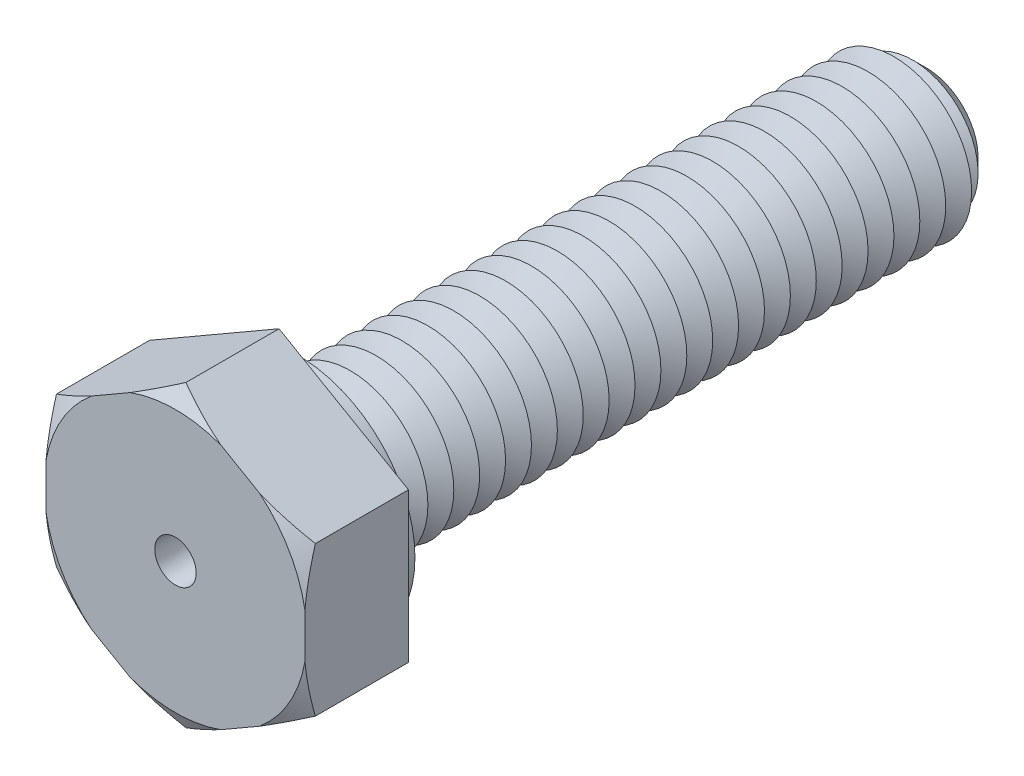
SolidWorks part; units mm, degrees
ref_plane "Front Plane" through (0, 0, 0) normal (0, 0, 1) x (1, 0, 0)
ref_plane "Top Plane" through (0, 0, 0) normal (0, 1, 0) x (1, 0, 0)
ref_plane "Right Plane" through (0, 0, 0) normal (1, 0, 0) x (0, 0, -1)
sketch "Sketch2" plane through (0, 0, 0) normal (0, 0, 1) x (1, 0, 0)
  line L1 (0, 5.7735) -> (-5, 2.8868)
  line L2 (-5, 2.8868) -> (-5, -2.8868)
  line L3 (-5, -2.8868) -> (0, -5.7735)
  line L4 (0, -5.7735) -> (5, -2.8868)
  line L5 (5, -2.8868) -> (5, 2.8868)
  line L6 (5, 2.8868) -> (0, 5.7735)
  circle A0 centre (0, 0) radius 5 construction
  dimension "D1" = 10
extrude "Boss-Extrude1" add sketch "Sketch2" along normal blind 4
sketch "Sketch3" plane through (0, 0, 0) normal (0, 0, -1) x (-1, 0, 0)
  circle A0 centre (0, 0) radius 3
  dimension "D1" = 6
extrude "Boss-Extrude2" add sketch "Sketch3" along normal blind 25
sketch "Sketch4" plane through (0, 0, 0) normal (0, 0, -1) x (-1, 0, 0)
  circle A0 centre (0, 0) radius 4.5
  dimension "D1" = 9
extrude "Boss-Extrude3" add sketch "Sketch4" along normal blind 0.75
sketch "Sketch5" plane through (0, 0, 0) normal (1, 0, 0) x (0, 0, -1)
  line L0 (-3.2117, 0) -> (6.3192, 0) construction
chamfer "Chamfer1" distance 1 angle 45 1 edges at (-3, 0, -25)
sketch "Sketch6" plane through (0, 0, 0) normal (1, 0, 0) x (0, 0, -1)
  line L0 (0.75, 3) -> (1.25, 2.134)
  line L1 (1.25, 2.134) -> (1.75, 3)
  line L2 (24, 3) -> (0.75, 3) construction
  line L3 (1.75, 3) -> (0.75, 3)
  dimension "D1" = 1
revolve "Cut-Revolve1" cut sketch "Sketch6" angle 360 about L0
pattern_linear "LPattern1" count 24 spacing 1 along (0, 0, -1) of "Cut-Revolve1"
sketch "Sketch7" plane through (0, 0, 0) normal (1, 0, 0) x (0, 0, -1)
  line L0 (-4, 5.7735) -> (-4, 5.0735)
  line L1 (-4, 2.8868) -> (-4, 5.7735) construction
  line L2 (-4, 5.0735) -> (-3.5959, 5.7735)
  line L3 (-4, 5.7735) -> (0, 5.7735) construction
  line L4 (-3.5959, 5.7735) -> (-4, 5.7735)
  dimension "D1" = 0.7
  dimension "D2" = 30
revolve "Cut-Revolve2" cut sketch "Sketch7" angle 360 about L0
sketch "Sketch8" plane through (0, 0, 4) normal (0, 0, 1) x (1, 0, 0)
  circle A0 centre (0, 0) radius 0.8
  dimension "D1" = 1.6
extrude "Cut-Extrude1" cut sketch "Sketch8" against normal up to surface (29 mm away)
